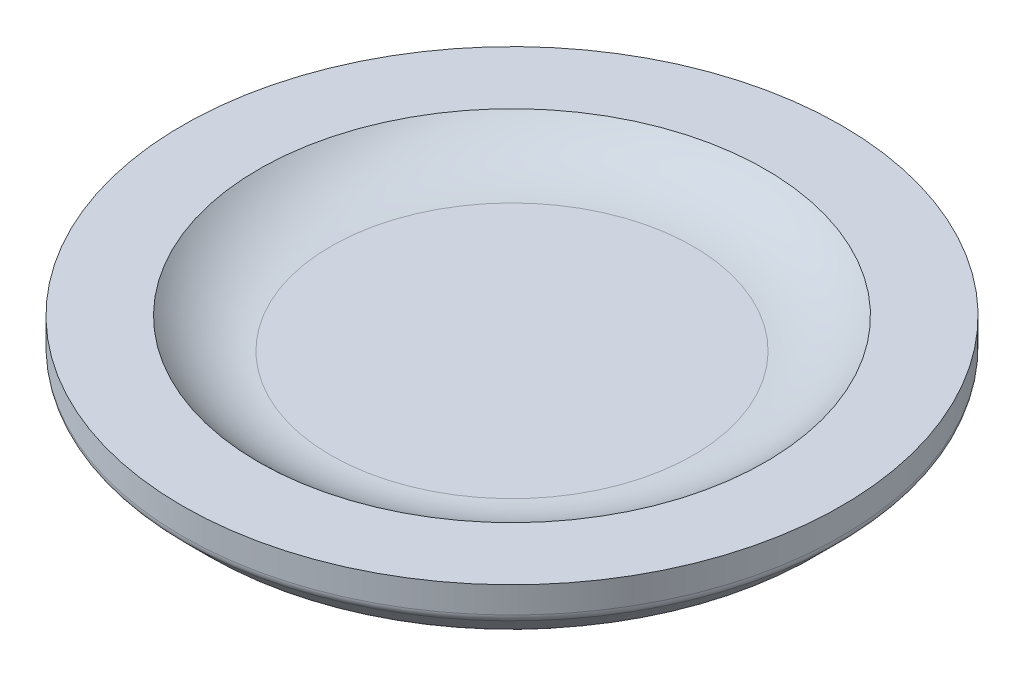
SolidWorks part; units mm, degrees
ref_plane "Front Plane" through (0, 0, 0) normal (0, 0, 1) x (1, 0, 0)
ref_plane "Top Plane" through (0, 0, 0) normal (0, 1, 0) x (1, 0, 0)
ref_plane "Right Plane" through (0, 0, 0) normal (1, 0, 0) x (0, 0, -1)
sketch "Sketch1" plane through (0, 0, 0) normal (0, 1, 0) x (1, 0, 0)
  circle A0 centre (0, 0) radius 32.5
  dimension "D1" = 65
extrude "Boss-Extrude1" add sketch "Sketch1" along normal blind 6
sketch "Sketch2" plane through (0, 6, 0) normal (0, 1, 0) x (1, 0, 0)
  circle A0 centre (0, 0) radius 25
  dimension "D1" = 50
extrude "Cut-Extrude1" cut sketch "Sketch2" against normal blind 3
fillet "Fillet1" radius 10 1 edges at (0, 3, 25)
chamfer "Chamfer1" distance 3 angle 45 1 edges at (0, 0, 32.5)
fillet "Fillet2" radius 1 2 edges at (0, 3, 32.5) (0, 0, 29.5)
